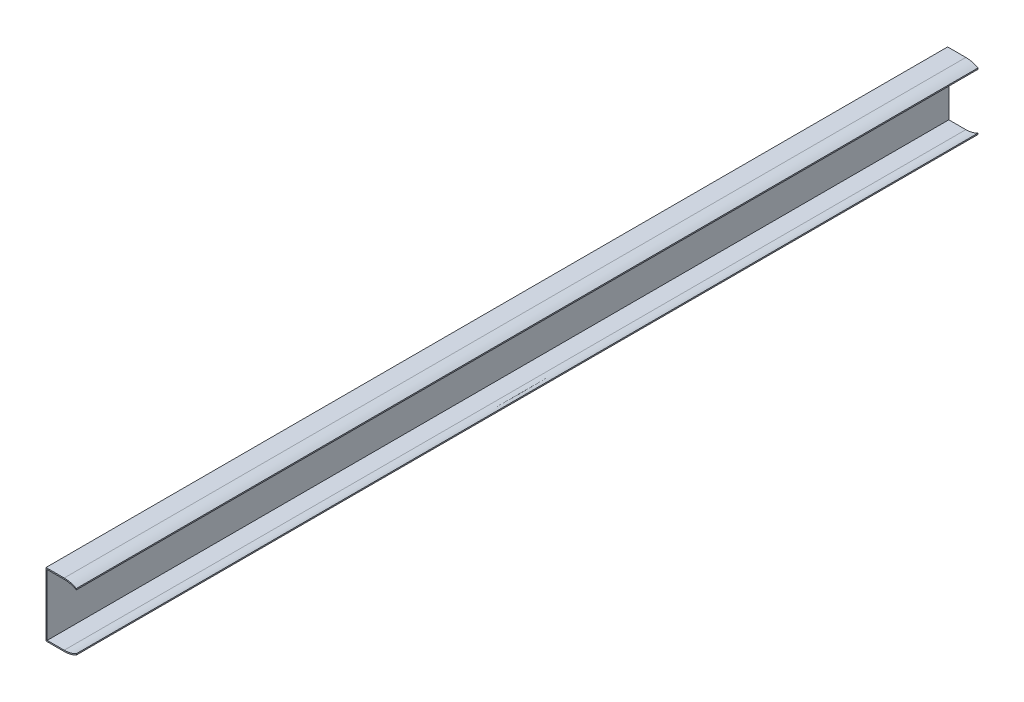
SolidWorks part; units mm, degrees
ref_plane "Plan de face" through (0, 0, 0) normal (0, 0, 1) x (1, 0, 0)
ref_plane "Plan de dessus" through (0, 0, 0) normal (0, 1, 0) x (1, 0, 0)
ref_plane "Plan de droite" through (0, 0, 0) normal (1, 0, 0) x (0, 0, -1)
sketch "Esquisse1" plane through (0, 0, 0) normal (0, 0, 1) x (1, 0, 0)
  line L0 (0, 0) -> (0, 105)
  line L1 (0, 105) -> (30, 105)
  line L2 (0, 52.5) -> (81.0721, 52.5) construction
  line L3 (2, 103) -> (2, 2)
  line L4 (0, 0) -> (30, 0)
  line L5 (2, 103) -> (30, 103)
  line L6 (50, 100) -> (50, 98)
  line L7 (50, 5) -> (50, 7)
  line L8 (2, 2) -> (30, 2)
  spline S0 degree 2 poles (30, 105) (40.6033, 104.9515) (50, 100) knots 0 0 0 1 1 1
  spline S1 degree 2 poles (30, 0) (40.6033, 0.0485) (50, 5) knots 0 0 0 1 1 1
  spline S2 degree 2 poles (30, 103) (40.6033, 102.9515) (50, 98) knots 0 0 0 1 1 1
  spline S3 degree 2 poles (30, 2) (40.6033, 2.0485) (50, 7) knots 0 0 0 1 1 1
  point P20 (2, 52.5)
  dimension "D1" = 105
  dimension "D2" = 30
  dimension "D3" = 5
  dimension "D4" = 50
  dimension "D5" = 1.2
  dimension "D6" = 10
  dimension "D7" = 5
  dimension "D8" = 10
  dimension "D9" = 1.2
  dimension "D10" = 28
  dimension "D11" = 20
  dimension "D12" = 2
  dimension "D13" = 2
extrude "Extrusion1" add sketch "Esquisse1" along normal blind 1485
